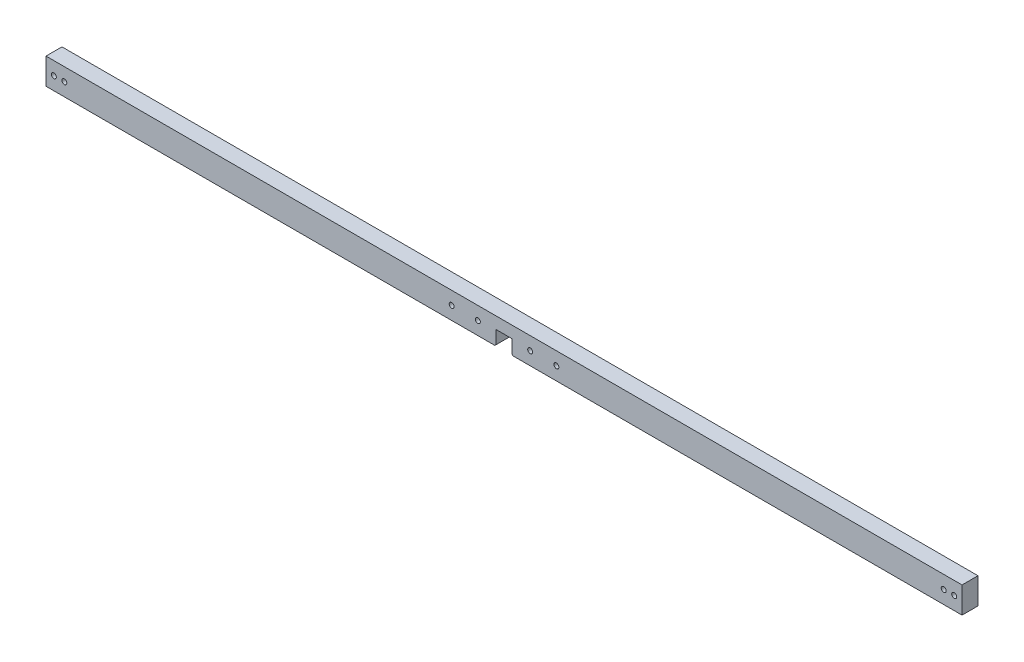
SolidWorks part; units mm, degrees
ref_plane "Front Plane" through (0, 0, 0) normal (0, 0, 1) x (1, 0, 0)
ref_plane "Top Plane" through (0, 0, 0) normal (0, 1, 0) x (1, 0, 0)
ref_plane "Right Plane" through (0, 0, 0) normal (1, 0, 0) x (0, 0, -1)
sketch "Sketch1" plane through (0, 0, 0) normal (0, 0, 1) x (1, 0, 0)
  line L1 (175, -5) -> (-175, -5)
  line L2 (175, -5) -> (175, 5)
  line L3 (175, 5) -> (-175, 5)
  line L4 (-175, -5) -> (-175, 5)
  line L5 (175, -5) -> (-175, 5) construction
  line L6 (175, 5) -> (-175, -5) construction
  point P0 (0, 0)
  dimension "D1" = 10
  dimension "D2" = 350
extrude "Boss-Extrude1" add sketch "Sketch1" along normal mid plane 6.1
sketch "Sketch2" plane through (0, 0, 3.05) normal (0, 0, 1) x (1, 0, 0)
  line L0 (0, 0) -> (175, 0) construction
  line L1 (175, -5) -> (175, 5) construction
  circle A0 centre (10, 0) radius 0.95
  circle A1 centre (20, 0) radius 0.95
  circle A2 centre (172, 0) radius 0.95
  circle A3 centre (168, 0) radius 0.95
  dimension "D4" = 1.9
  dimension "D1" = 10
  dimension "D2" = 10
  dimension "D7" = 3
  dimension "D8" = 7
extrude "Cut-Extrude1" cut sketch "Sketch2" against normal through all
mirror "Mirror1" about plane through (0, 0, 0) normal (1, 0, 0) of "Cut-Extrude1"
sketch "Sketch4" plane through (0, 0, 3.05) normal (0, 0, 1) x (1, 0, 0)
  line L0 (0, 6.6421) -> (0, -8.4324) construction
  line L2 (-3, -12.5622) -> (3, -12.5622)
  line L3 (-3, -12.5622) -> (-3, 0.5)
  line L4 (-3, 0.5) -> (3, 0.5)
  line L5 (3, -12.5622) -> (3, 0.5)
  line L6 (-3, -12.5622) -> (3, 0.5) construction
  line L7 (-3, 0.5) -> (3, -12.5622) construction
  point P3 (0, -6.0311)
  dimension "D1" = 6
  dimension "D2" = 0.5
extrude "Cut-Extrude2" cut sketch "Sketch4" against normal blind 10
chamfer "Chamfer1" distance 0.5 angle 45 2 edges at (3, -5, 0) (-3, -5, 0)
